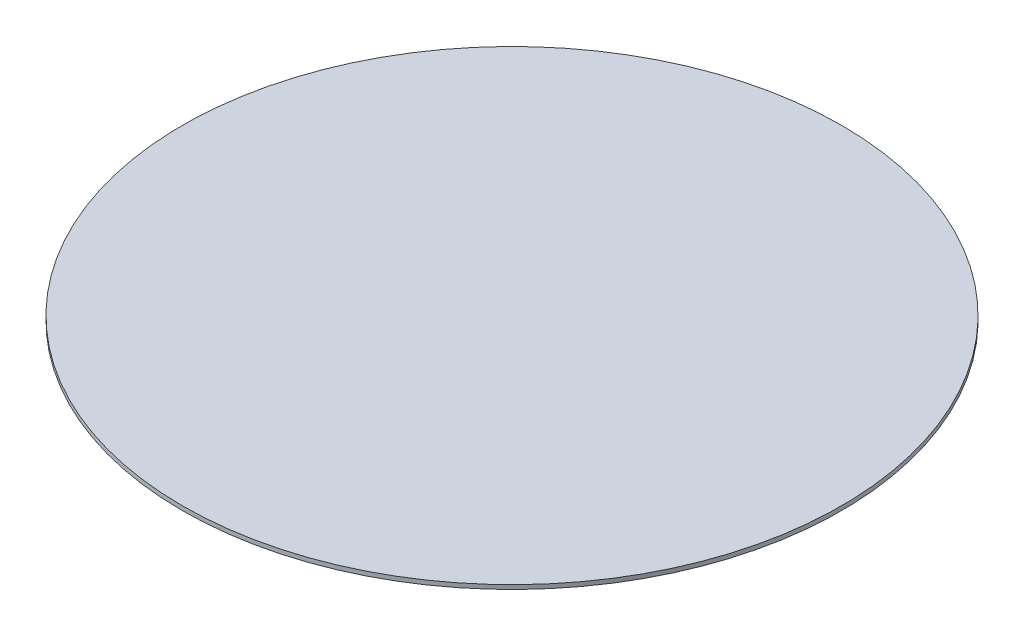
SolidWorks part; units mm, degrees
ref_plane "Front" through (0, 0, 0) normal (0, 0, 1) x (1, 0, 0)
ref_plane "Top" through (0, 0, 0) normal (0, 1, 0) x (1, 0, 0)
ref_plane "Right" through (0, 0, 0) normal (1, 0, 0) x (0, 0, -1)
sketch "Sketch1" plane through (0, 0, 0) normal (0, 1, 0) x (1, 0, 0)
  circle A0 centre (0, 0) radius 23.5
  dimension "D1" = 47
extrude "Boss-Extrude1" add sketch "Sketch1" along normal blind 0.3
